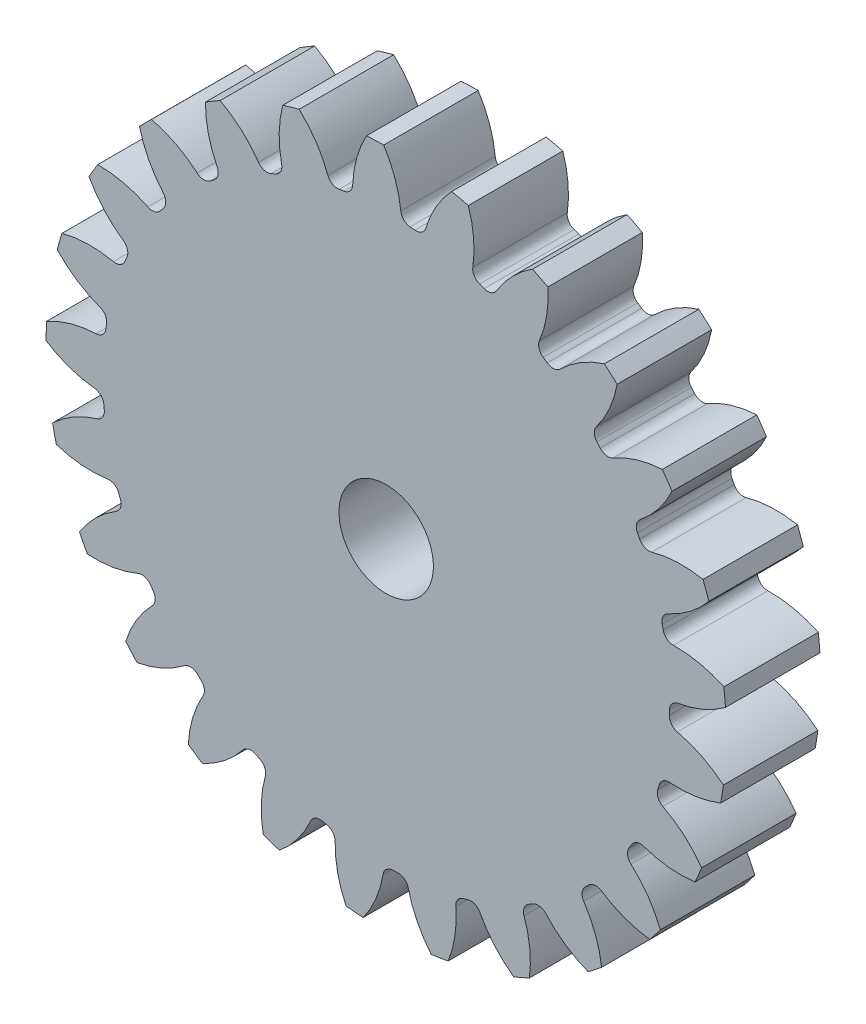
SolidWorks part; units mm, degrees
ref_plane "Front" through (0, 0, 0) normal (0, 0, 1) x (1, 0, 0)
ref_plane "Top" through (0, 0, 0) normal (0, 1, 0) x (1, 0, 0)
ref_plane "Right" through (0, 0, 0) normal (1, 0, 0) x (0, 0, -1)
sketch "Sketch3" plane through (0, 0, 0) normal (0, 0, 1) x (1, 0, 0)
  circle A0 centre (0, 0) radius 457.2
  dimension "od" = 914.4
extrude "gearBody" add sketch "Sketch3" along normal blind 127
sketch "Sketch2" plane through (0, 0, 0) normal (0, 0, 1) x (1, 0, 0)
  line L0 (0, 0) -> (367.5222, 152.2327) construction
  line L1 (454.3654, -60.5359) -> (0, 0) construction
  line L2 (0, 0) -> (36.3143, 0) construction
  line L3 (423.1124, 13.6741) -> (421.5047, -39.305) construction
  line L5 (422.3086, -12.8155) -> (0, 0) construction
  line L7 (0, 0) -> (397.8032, 0) construction
  arc A0 (397.7575, 6.0322) -> (396.6598, -30.1398) centre (0, 0) ccw construction
  arc A1 (456.0762, 32.0372) -> (453.2943, -59.6332) centre (0, 0) ccw construction
  arc A2 (423.1124, 13.6741) -> (421.5047, -39.305) centre (0, 0) ccw construction
  arc A3 (380.7107, -14.8452) -> (380.9103, -8.2671) centre (0, 0) ccw
  arc A4 (454.3654, -60.5359) -> (391.3677, -28.8092) centre (357.6151, -174.2379) ccw
  arc A5 (454.3654, -60.5359) -> (457.2, 32.8733) centre (0, 0) ccw
  arc A6 (457.2, 32.8733) -> (392.3944, 5.0249) centre (367.5222, 152.2327) cw
  arc A7 (380.9103, -8.2671) -> (392.3944, 5.0249) centre (394.6908, -8.5662) cw
  arc A8 (391.3677, -28.8092) -> (380.7107, -14.8452) centre (394.4839, -15.3823) cw
  point P6 (457.2, 32.8733)
  point P22 (454.3654, -60.5359)
  dimension "baseDia" = 795.6064
  dimension "od" = 914.4
  dimension "pd" = 846.6667
  dimension "rd" = 762
  dimension "rFillet" = 13.7837
  dimension "pointX" = 457.2
  dimension "pointY" = 32.8733
  dimension "CTT" = 52.9791
  dimension "flankCenterAngle" = 22.5
extrude "toothCut" cut sketch "Sketch2" along normal through all
pattern_circular "CirPattern1" count 25 over 360 about axis through (0, 0, 0) along (0, 0, 1) of "toothCut"
sketch "hub1Dia" plane through (0, 0, 0) normal (0, 0, -1) x (-1, 0, 0)
  circle A0 centre (0, 0) radius 12.7
  dimension "hub1Dia" = 25.4
sketch "hub2Dia" plane through (0, 0, 127) normal (0, 0, 1) x (1, 0, 0)
  circle A0 centre (0, 0) radius 12.7
  dimension "hub2dia" = 25.4
sketch "boreDia" plane through (0, 0, 0) normal (0, 0, 1) x (1, 0, 0)
  circle A0 centre (0, 0) radius 63.5
  dimension "boreDia" = 127
extrude "bore" cut sketch "boreDia" against normal mid plane 25400
